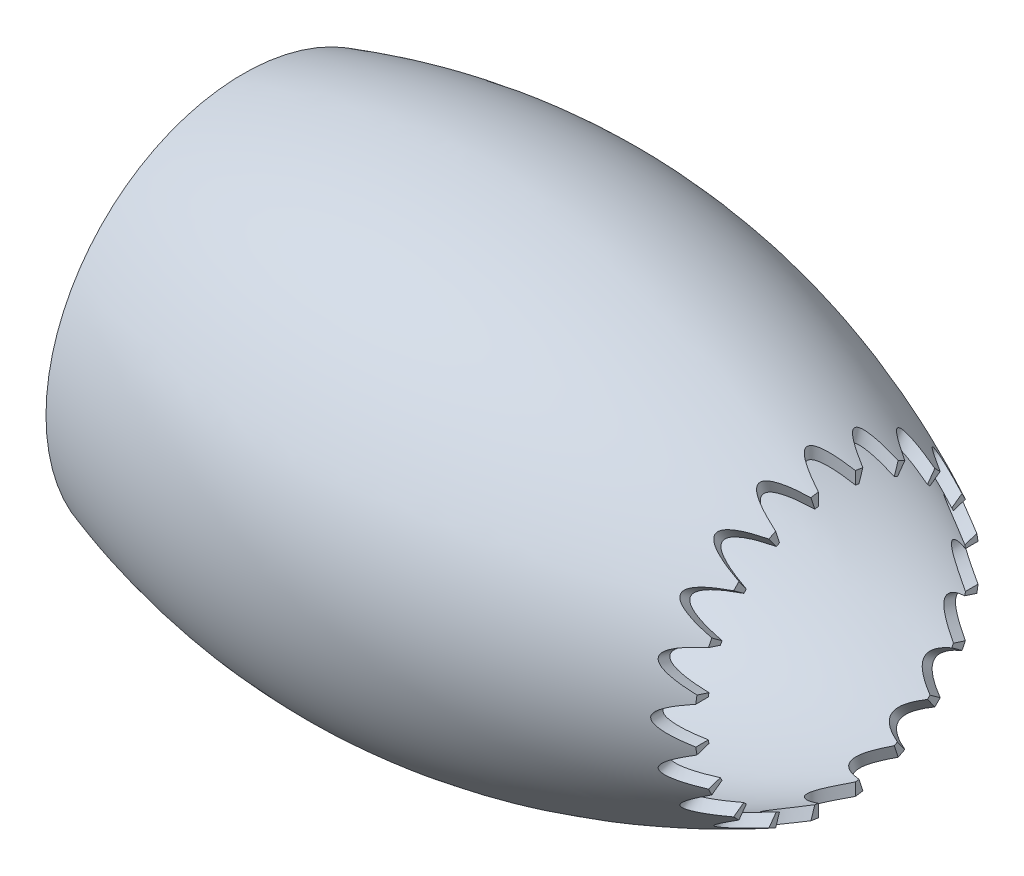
SolidWorks part; units mm, degrees
ref_plane "Front Plane" through (0, 0, 0) normal (0, 0, 1) x (1, 0, 0)
ref_plane "Top Plane" through (0, 0, 0) normal (0, 1, 0) x (1, 0, 0)
ref_plane "Right Plane" through (0, 0, 0) normal (1, 0, 0) x (0, 0, -1)
sketch "Sketch2" plane through (0, 0, 0) normal (0, 0, 1) x (1, 0, 0)
  line L0 (0, 0) -> (4064, 0)
  line L1 (4064, 0) -> (4064, 889)
  line L2 (0, 0) -> (0, 1270)
  line L3 (1524, 337.5828) -> (1524, 50337.5828) construction
  line L4 (5016.7686, 1524) -> (-1536.8403, 1524) construction
  spline S0 degree 2 poles (0, 1270) (2011.2835, 1925.6093) (4064, 889) knots 0 0 0 1 1 1
  point P6 (0, 0)
  point P8 (0, 0)
  point P10 (0, 0)
  dimension "D4" = 1524
  dimension "D1" = 1270
  dimension "D2" = 889
  dimension "D3" = 4064
  dimension "D5" = 1524
revolve "Revolve4" add sketch "Sketch2" angle 360 about L0
shell "Shell6" thickness 76.2
ref_plane "Plane1" through (0, 0, 1016) normal (0, 0, 1) x (1, 0, 0)
sketch "Sketch4" plane through (0, 0, 1016) normal (0, 0, 1) x (1, 0, 0)
  line L0 (4064, -1000) -> (4064, 49000) construction
  line L1 (4064, -889) -> (4064, 889) construction
  line L2 (-1000, 0) -> (49000, 0) construction
  line L3 (4064, 127) -> (4064, -127)
  spline S0 degree 2 poles (4064, 127) (3657.6, 0) (4064, -127) knots 0 0 0 1 1 1
  point P5 (4064, 0)
  dimension "D1" = 254
  dimension "D2" = 203.2
  dimension "D3" = 127
extrude "Cut-Extrude3" cut sketch "Sketch4" against normal blind 254 and the other way through all
pattern_circular "CirPattern1" count 20 over 360 about axis through (0, 0, 0) along (1, 0, 0) of "Cut-Extrude3"
